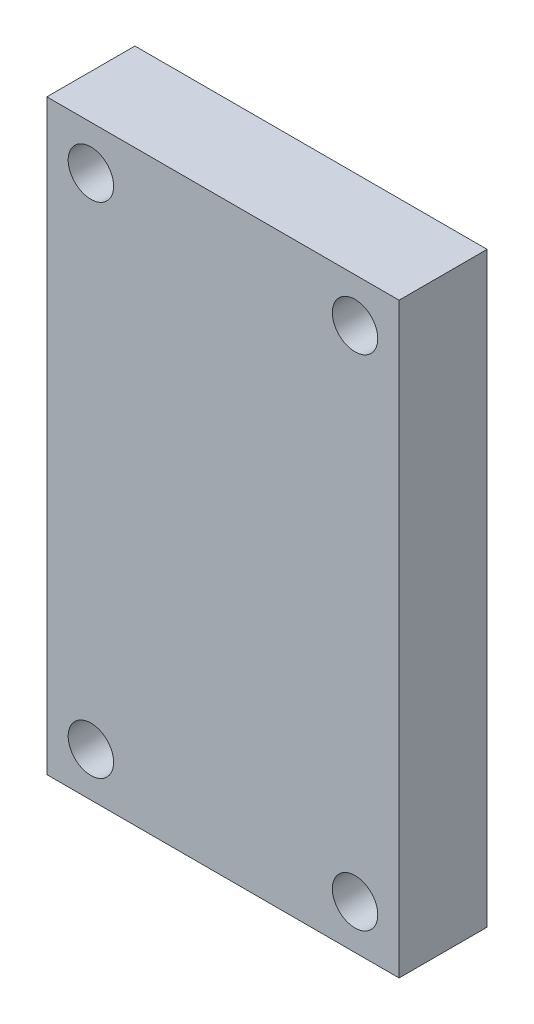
SolidWorks part; units mm, degrees
ref_plane "Front Plane" through (0, 0, 0) normal (0, 0, 1) x (1, 0, 0)
ref_plane "Top Plane" through (0, 0, 0) normal (0, 1, 0) x (1, 0, 0)
ref_plane "Right Plane" through (0, 0, 0) normal (1, 0, 0) x (0, 0, -1)
sketch "Sketch1" plane through (0, 0, 0) normal (0, 0, 1) x (1, 0, 0)
  line L0 (0, 0) -> (0, 63.5)
  line L1 (0, 63.5) -> (38.1, 63.5)
  line L2 (38.1, 63.5) -> (38.1, 0)
  line L3 (38.1, 0) -> (0, 0)
  dimension "D1" = 63.5
  dimension "D2" = 38.1
extrude "Boss-Extrude1" add sketch "Sketch1" along normal blind 9.525
sketch "Sketch5" plane through (0, 0, 9.525) normal (0, 0, 1) x (1, 0, 0)
  line L0 (0, 58.7375) -> (38.1, 58.7375) construction
  line L1 (0, 63.5) -> (0, 0) construction
  line L2 (38.1, 0) -> (38.1, 63.5) construction
  line L3 (38.1, 63.5) -> (0, 63.5) construction
  line L4 (0, 31.75) -> (38.1, 31.75) construction
  line L5 (0, 4.7625) -> (38.1, 4.7625) construction
  line L6 (19.05, 63.5) -> (19.05, 0) construction
  line L7 (0, 0) -> (38.1, 0) construction
  line L8 (4.7625, 63.5) -> (4.7625, 0) construction
  line L9 (33.3375, 63.5) -> (33.3375, 0) construction
  point P20 (4.7625, 58.7375)
  point P21 (19.05, 58.7375)
  point P22 (33.3375, 58.7375)
  point P23 (33.3375, 31.75)
  point P24 (4.7625, 31.75)
  dimension "D1" = 4.7625
  dimension "D2" = 4.7625
hole_wizard "#10 (0.1935) Diameter Hole1" positions "Sketch7" profile "Sketch6" hole size "#10" standard "ANSI Inch"
sketch "Sketch7" plane through (0, 0, 9.525) normal (0, 0, 1) x (1, 0, 0)
  line L0 (0, 4.7625) -> (38.1, 4.7625) construction
  line L1 (4.7625, 63.5) -> (4.7625, 0) construction
  line L2 (33.3375, 63.5) -> (33.3375, 0) construction
  point P0 (4.7625, 58.7375)
  point P3 (33.3375, 58.7375)
  point P6 (4.7625, 4.7625)
  point P12 (33.3375, 4.7625)
sketch "Sketch6" plane through (4.7625, 58.7375, 9.525) normal (1, 0, 0) x (0, -1, 0)
  line L0 (0, 0) -> (0, 9.525)
  line L1 (0, 9.525) -> (2.4574, 9.525)
  line L2 (2.4574, 9.525) -> (2.4574, 0)
  line L5 (2.4574, 0) -> (0, 0)
  line L11 (0, -6.35) -> (0, 107.95) construction
  dimension "Thru Hole Dia." = 4.9149
  dimension "Thru Hole Depth" = 9.525
